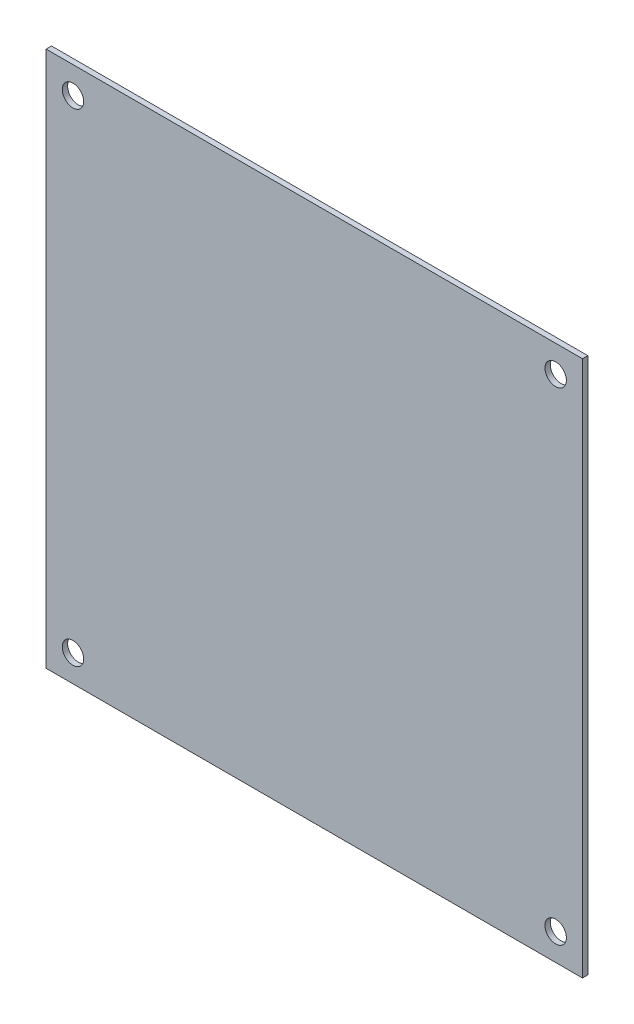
SolidWorks part; units mm, degrees
ref_plane "前视基准面" through (0, 0, 0) normal (0, 0, 1) x (1, 0, 0)
ref_plane "上视基准面" through (0, 0, 0) normal (0, 1, 0) x (1, 0, 0)
ref_plane "右视基准面" through (0, 0, 0) normal (1, 0, 0) x (0, 0, -1)
other "Configuration Table"
sketch "草图1" plane through (0, 0, 0) normal (0, 0, 1) x (1, 0, 0)
  line L5 (-250, 250) -> (250, 250)
  line L11 (-250, 250) -> (-250, -250)
  line L12 (-250, -250) -> (250, -250)
  line L13 (250, 250) -> (250, -250)
  line L14 (-250, 250) -> (250, -250) construction
  line L15 (-250, -250) -> (250, 250) construction
  line L16 (-225, 225) -> (225, 225) construction
  line L17 (-225, 225) -> (-225, -225) construction
  line L18 (-225, -225) -> (225, -225) construction
  line L19 (225, 225) -> (225, -225) construction
  line L20 (-225, 225) -> (225, -225) construction
  line L21 (-225, -225) -> (225, 225) construction
  circle A0 centre (-225, 225) radius 10
  circle A1 centre (225, 225) radius 10
  circle A2 centre (225, -225) radius 10
  circle A3 centre (-225, -225) radius 10
  point P0 (0, 0)
  point P5 (0, 0)
extrude "凸台-拉伸1" add sketch "草图1" along normal blind 5
